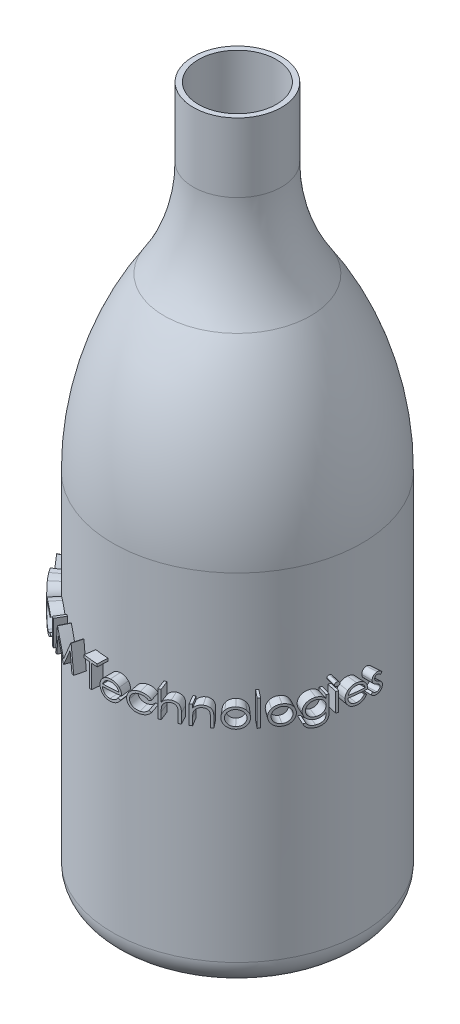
SolidWorks part; units mm, degrees
ref_plane "Front" through (0, 0, 0) normal (0, 0, 1) x (1, 0, 0)
ref_plane "Top" through (0, 0, 0) normal (0, 1, 0) x (1, 0, 0)
ref_plane "Right" through (0, 0, 0) normal (1, 0, 0) x (0, 0, -1)
sketch "Sketch1" plane through (0, 0, 0) normal (0, 0, 1) x (1, 0, 0)
  line L0 (0, 0) -> (24, 0)
  line L1 (24, 0) -> (24, 70)
  line L2 (8.5, 121.7083) -> (8.5, 135)
  line L3 (8.5, 135) -> (0, 135)
  line L4 (0, 135) -> (0, 0)
  arc A0 (24, 70) -> (14.1064, 103.0053) centre (-36, 70) ccw
  arc A1 (14.1064, 103.0053) -> (8.5, 121.7083) centre (42.5, 121.7083) cw
  dimension "D3" = 60
  dimension "D4" = 34
  dimension "D1" = 135
  dimension "D2" = 24
  dimension "D5" = 8.5
  dimension "D6" = 70
revolve "Revolve1" add sketch "Sketch1" angle 360 about L4
fillet "Fillet1" radius 5 1 edges at (-24, 0, 0)
shell "Shell1" thickness 1
ref_plane "Plane1" through (0, 0, 30) normal (0, 0, 1) x (1, 0, 0)
sketch "Sketch2" plane through (0, 0, 30) normal (0, 0, 1) x (1, 0, 0)
  text T0 "CADCIM Technologies" font "Century Gothic" height in points 14
wrap "Wrap1" sketch "Sketch2" wrap type emboss source sketch "Sketch2" thickness 2 parameters "D1"=2
